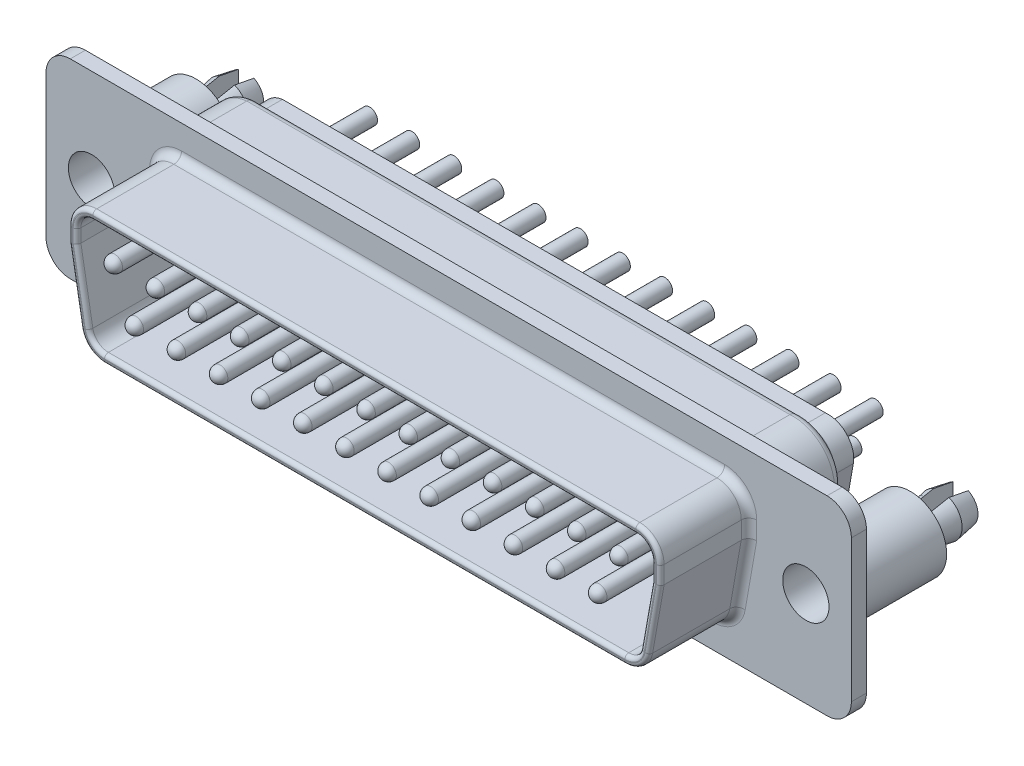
SolidWorks part; units mm, degrees
ref_plane "Plane1" through (0, 0, 0) normal (0, 0, 1) x (1, 0, 0)
ref_plane "Plane2" through (0, 0, 0) normal (0, 1, 0) x (1, 0, 0)
ref_plane "Plane3" through (0, 0, 0) normal (1, 0, 0) x (0, 0, -1)
sketch "Sketch1" plane through (0, 0, 0) normal (0, 0, 1) x (1, 0, 0)
  line L0 (0, 19.6596) -> (0, -19.1008) construction
  line L1 (-24.9174, 6.2738) -> (24.9174, 6.2738)
  line L2 (24.9174, -6.2738) -> (-24.9174, -6.2738)
  line L3 (26.5176, 4.6736) -> (26.5176, -4.6736)
  line L4 (-26.5176, 4.6736) -> (-26.5176, -4.6736)
  arc A0 (26.5176, 4.6736) -> (24.9174, 6.2738) centre (24.9174, 4.6736) ccw
  arc A1 (24.9174, -6.2738) -> (26.5176, -4.6736) centre (24.9174, -4.6736) ccw
  arc A2 (-26.5176, -4.6736) -> (-24.9174, -6.2738) centre (-24.9174, -4.6736) ccw
  arc A3 (-24.9174, 6.2738) -> (-26.5176, 4.6736) centre (-24.9174, 4.6736) ccw
  point P9 (26.5176, 6.2738)
  point P12 (26.5176, -6.2738)
  point P15 (-26.5176, -6.2738)
  point P18 (-26.5176, 6.2738)
  dimension "D1" = 1.6002
extrude "Base-Extrude" add sketch "Sketch1" against normal blind 0.9906
sketch "Sketch3" plane through (0, 0, 0) normal (0, 0, 1) x (1, 0, 0)
  line L0 (0, 9.4234) -> (0, -12.192) construction
  line L1 (-17.5895, 4.1783) -> (18.1737, 4.1783)
  line L2 (17.4436, -4.1783) -> (-16.8191, -4.1783)
  line L4 (19.7739, 1.4224) -> (19.0195, -2.856)
  line L5 (19.7739, 2.5781) -> (19.7739, 1.4224)
  line L6 (-19.1897, 1.651) -> (-18.395, -2.856)
  line L7 (-19.1897, 2.5781) -> (-19.1897, 1.651)
  arc A0 (18.1737, 4.1783) -> (19.7739, 2.5781) centre (18.1737, 2.5781) cw
  arc A1 (17.4436, -4.1783) -> (19.0195, -2.856) centre (17.4436, -2.5781) ccw
  arc A2 (-18.395, -2.856) -> (-16.8191, -4.1783) centre (-16.8191, -2.5781) ccw
  arc A3 (-17.5895, 4.1783) -> (-19.1897, 2.5781) centre (-17.5895, 2.5781) ccw
  point P19 (19.7739, 4.1783)
  point P26 (-19.1897, 4.1783)
  dimension "D7" = 1.6002
  dimension "D1" = 38.9636
  dimension "D3" = 4.1783
  dimension "D4" = 4.1783
  dimension "D5" = 10
  dimension "D6" = 10
extrude "Boss-Extrude2" add sketch "Sketch3" along normal blind 5.842
sketch "Sketch10" plane through (0, 0, 0) normal (0, 0, 1) x (1, 0, 0)
  line L0 (0, 10.3378) -> (0, -10.8966) construction
  line L1 (-24.9174, 6.2738) -> (24.9174, 6.2738) construction
  circle A0 centre (23.5204, 0) radius 1.524
  circle A1 centre (-23.5204, 0) radius 1.524
  dimension "D1" = 3.048
  dimension "D2" = 6.2738
  dimension "D3" = 47.0408
extrude "Cut-Extrude5" cut sketch "Sketch10" against normal through all
sketch "Sketch11" plane through (0, 0, 5.842) normal (0, 0, 1) x (1, 0, 0)
  circle A0 centre (0, 1.4224) radius 0.508
  circle A2 centre (16.6497, 1.4224) radius 0.508
  circle A3 centre (11.1023, 1.4224) radius 0.508
  circle A4 centre (-2.7813, 1.4224) radius 0.508
  circle A5 centre (8.3287, 1.4224) radius 0.508
  circle A6 centre (-8.3287, 1.4224) radius 0.508
  circle A7 centre (5.555, 1.4224) radius 0.508
  circle A8 centre (-11.1023, 1.4224) radius 0.508
  circle A9 centre (2.7813, 1.4224) radius 0.508
  circle A10 centre (-13.876, 1.4224) radius 0.508
  circle A11 centre (13.876, 1.4224) radius 0.508
  circle A12 centre (-16.6497, 1.4224) radius 0.508
  circle A13 centre (15.2476, -1.4224) radius 0.508
  circle A25 centre (-5.555, 1.4224) radius 0.508
  circle A26 centre (-15.2629, -1.4224) radius 0.508
  circle A27 centre (12.4739, -1.4224) radius 0.508
  circle A28 centre (-12.4892, -1.4224) radius 0.508
  circle A29 centre (9.7003, -1.4224) radius 0.508
  circle A30 centre (-9.7155, -1.4224) radius 0.508
  circle A31 centre (6.9266, -1.4224) radius 0.508
  circle A32 centre (-6.9418, -1.4224) radius 0.508
  circle A33 centre (4.1529, -1.4224) radius 0.508
  circle A34 centre (-4.1681, -1.4224) radius 0.508
  circle A35 centre (1.3792, -1.4224) radius 0.508
  circle A36 centre (-1.3945, -1.4224) radius 0.508
  dimension "D2" = 1.016
  dimension "D5" = 2.7737
  dimension "D6" = 2.7737
  dimension "D7" = 2.7737
  dimension "D8" = 2.7737
  dimension "D9" = 2.7737
  dimension "D10" = 2.7737
  dimension "D11" = 2.7737
  dimension "D12" = 2.7737
  dimension "D13" = 2.7737
  dimension "D14" = 2.7737
  dimension "D15" = 1.3868
  dimension "D16" = 2.7737
  dimension "D17" = 2.7737
  dimension "D18" = 2.7737
  dimension "D19" = 2.7737
  dimension "D20" = 2.7737
  dimension "D21" = 2.7737
  dimension "D22" = 2.7737
  dimension "D23" = 2.7737
  dimension "D24" = 2.7737
  dimension "D25" = 2.7737
  dimension "D26" = 2.7737
ref_plane "Plane5" through (5.715, 0, 0) normal (1, 0, 0) x (0, 0, -1)
sketch "Sketch16" plane through (0, 0, 5.842) normal (0, 0, 1) x (1, 0, 0)
  line L6 (19.2151, 1.4713) -> (19.2151, 2.5781)
  line L7 (18.1737, 3.6195) -> (-17.5895, 3.6195)
  line L8 (-18.6309, 2.5781) -> (-18.6309, 1.6999)
  line L9 (-18.6309, 1.6999) -> (-17.8447, -2.7589)
  line L10 (-16.8191, -3.6195) -> (17.4436, -3.6195)
  line L11 (18.4692, -2.7589) -> (19.2151, 1.4713)
  line L12 (19.2151, 1.4713) -> (19.2151, 2.5781)
  line L13 (18.1737, 3.6195) -> (-17.5895, 3.6195)
  line L14 (-18.6309, 2.5781) -> (-18.6309, 1.6999)
  line L15 (-18.6309, 1.6999) -> (-17.8447, -2.7589)
  line L16 (-16.8191, -3.6195) -> (17.4436, -3.6195)
  line L17 (18.4692, -2.7589) -> (19.2151, 1.4713)
  arc A4 (19.2151, 2.5781) -> (18.1737, 3.6195) centre (18.1737, 2.5781) ccw
  arc A5 (-17.5895, 3.6195) -> (-18.6309, 2.5781) centre (-17.5895, 2.5781) ccw
  arc A6 (-17.8447, -2.7589) -> (-16.8191, -3.6195) centre (-16.8191, -2.5781) ccw
  arc A7 (17.4436, -3.6195) -> (18.4692, -2.7589) centre (17.4436, -2.5781) ccw
  arc A8 (19.2151, 2.5781) -> (18.1737, 3.6195) centre (18.1737, 2.5781) ccw
  arc A9 (-17.5895, 3.6195) -> (-18.6309, 2.5781) centre (-17.5895, 2.5781) ccw
  arc A10 (-17.8447, -2.7589) -> (-16.8191, -3.6195) centre (-16.8191, -2.5781) ccw
  arc A11 (17.4436, -3.6195) -> (18.4692, -2.7589) centre (17.4436, -2.5781) ccw
  dimension "D1" = 0.5588
extrude "Cut-Extrude6" cut sketch "Sketch16" against normal blind 5.842
extrude "Boss-Extrude7" add sketch "Sketch11" against normal blind 5.842
fillet "Fillet1" radius 0.508 25 edges at (0.508, 1.4224, 5.842) (-17.1577, 1.4224, 5.842) (-14.384, 1.4224, 5.842) (-11.6103, 1.4224, 5.842) (-8.8367, 1.4224, 5.842) (-6.063, 1.4224, 5.842) (-3.2893, 1.4224, 5.842) (2.2733, 1.4224, 5.842) (5.047, 1.4224, 5.842) (7.8207, 1.4224, 5.842) (10.5943, 1.4224, 5.842) (13.368, 1.4224, 5.842) (16.1417, 1.4224, 5.842) (15.7556, -1.4224, 5.842) (12.9819, -1.4224, 5.842) (10.2083, -1.4224, 5.842) (7.4346, -1.4224, 5.842) (4.6609, -1.4224, 5.842) (1.8872, -1.4224, 5.842) (-1.9025, -1.4224, 5.842) (-4.6761, -1.4224, 5.842) (-7.4498, -1.4224, 5.842) (-10.2235, -1.4224, 5.842) (-12.9972, -1.4224, 5.842) (-15.7709, -1.4224, 5.842)
fillet "Fillet3" radius 0.254 20 edges at (19.7739, 2.0003, 5.842) (19.3052, 3.7096, 5.842) (0.2921, 4.1783, 5.842) (0.3123, -4.1783, 5.842) (19.3967, -0.7168, 5.842) (-18.721, 3.7096, 5.842) (-19.1897, 2.1146, 5.842) (-18.7923, -0.6025, 5.842) (-17.8477, -3.8039, 5.842) (18.4722, -3.8039, 5.842) (18.8421, -0.6438, 5.842) (19.2151, 2.0247, 5.842) (18.9101, 3.3145, 5.842) (0.2921, 3.6195, 5.842) (-18.3259, 3.3145, 5.842) (-18.6309, 2.139, 5.842) (-18.2378, -0.5295, 5.842) (-17.4885, -3.3759, 5.842) (0.3123, -3.6195, 5.842) (18.113, -3.3759, 5.842)
fillet "Fillet4" radius 0.508 10 edges at (-18.721, 3.7096, 0) (-19.1897, 2.1146, 0) (-18.7923, -0.6025, 0) (-17.8477, -3.8039, 0) (18.4722, -3.8039, 0) (19.7739, 2.0003, 0) (19.3967, -0.7168, 0) (0.3123, -4.1783, 0) (0.2921, 4.1783, 0) (19.3052, 3.7096, 0)
sketch "Sketch17" plane through (0, 0, -0.9906) normal (0, 0, -1) x (-1, 0, 0)
  line L12 (17.891, 5.0831) -> (-17.8722, 5.0831)
  line L13 (-20.7641, 1.9186) -> (-19.8811, -3.089)
  line L14 (-17.3638, -5.0673) -> (16.7763, -5.0673)
  line L15 (19.2779, -2.9682) -> (20.0803, 1.5826)
  arc A0 (20.0803, 1.5826) -> (17.891, 5.0831) centre (17.6129, 2.4742) ccw
  arc A9 (16.7763, -5.0673) -> (19.2779, -2.9682) centre (16.8191, -2.5781) ccw
  arc A10 (-17.3638, -5.0673) -> (-19.8811, -3.089) centre (-17.4436, -2.5781) cw
  arc A11 (-20.7641, 1.9186) -> (-17.8722, 5.0831) centre (-18.1007, 2.3882) cw
extrude "Boss-Extrude8" add sketch "Sketch17" along normal blind 4.1148
sketch "Sketch18" plane through (0, 0, -5.1054) normal (0, 0, -1) x (-1, 0, 0)
  line L12 (17.8304, 4.0671) -> (-17.9202, 4.0671)
  line L13 (-19.7635, 2.095) -> (-18.8838, -2.8944)
  line L14 (-17.3822, -4.0513) -> (16.7862, -4.0513)
  line L15 (18.2756, -2.8015) -> (19.0969, 1.856)
  line L16 (17.8304, 4.0671) -> (-17.9202, 4.0671)
  line L17 (-19.7635, 2.095) -> (-18.8838, -2.8944)
  line L18 (-17.3822, -4.0513) -> (16.7862, -4.0513)
  line L19 (18.2756, -2.8015) -> (19.0969, 1.856)
  arc A12 (19.0969, 1.856) -> (17.8304, 4.0671) centre (17.6129, 2.4742) ccw
  arc A13 (-17.9202, 4.0671) -> (-19.7635, 2.095) centre (-18.1007, 2.3882) ccw
  arc A14 (-18.8838, -2.8944) -> (-17.3822, -4.0513) centre (-17.4436, -2.5781) ccw
  arc A15 (16.7862, -4.0513) -> (18.2756, -2.8015) centre (16.8191, -2.5781) ccw
  arc A16 (19.0969, 1.856) -> (17.8304, 4.0671) centre (17.6129, 2.4742) ccw
  arc A17 (-17.9202, 4.0671) -> (-19.7635, 2.095) centre (-18.1007, 2.3882) ccw
  arc A18 (-18.8838, -2.8944) -> (-17.3822, -4.0513) centre (-17.4436, -2.5781) ccw
  arc A19 (16.7862, -4.0513) -> (18.2756, -2.8015) centre (16.8191, -2.5781) ccw
  dimension "D2" = 1.016
extrude "Boss-Extrude9" add sketch "Sketch18" along normal blind 1.778
fillet "Fillet8" radius 0.508 16 edges at (20.0971, 4.2127, -5.1054) (18.9825, -4.5363, -5.1054) (-19.8373, 3.8655, -5.1054) (-0.0094, 5.0831, -5.1054) (20.3226, -0.5852, -5.1054) (0.2937, -5.0673, -5.1054) (-18.4194, -4.4852, -5.1054) (-19.6791, -0.6928, -5.1054) (-19.0079, 3.2733, -5.1054) (0.0449, 4.0671, -5.1054) (19.3342, 3.5413, -5.1054) (19.3237, -0.3997, -5.1054) (18.3435, -3.7461, -5.1054) (0.298, -4.0513, -5.1054) (-17.7663, -3.7069, -5.1054) (-18.6863, -0.4727, -5.1054)
sketch "Sketch19" plane through (0, 0, -6.8834) normal (0, 0, -1) x (-1, 0, 0)
  circle A0 centre (-16.6497, 1.4224) radius 0.508 construction
  circle A1 centre (-16.6497, 1.4224) radius 0.508
  circle A2 centre (-13.876, 1.4224) radius 0.508 construction
  circle A3 centre (-13.876, 1.4224) radius 0.508
  circle A4 centre (5.555, 1.4224) radius 0.508 construction
  circle A5 centre (5.555, 1.4224) radius 0.508
  circle A6 centre (16.6497, 1.4224) radius 0.508 construction
  circle A7 centre (16.6497, 1.4224) radius 0.508
  circle A8 centre (15.2629, -1.4224) radius 0.508 construction
  circle A9 centre (15.2629, -1.4224) radius 0.508
  circle A10 centre (12.4892, -1.4224) radius 0.508 construction
  circle A11 centre (12.4892, -1.4224) radius 0.508
  circle A12 centre (13.876, 1.4224) radius 0.508 construction
  circle A13 centre (13.876, 1.4224) radius 0.508
  circle A14 centre (11.1023, 1.4224) radius 0.508 construction
  circle A15 centre (11.1023, 1.4224) radius 0.508
  circle A16 centre (9.7155, -1.4224) radius 0.508 construction
  circle A17 centre (9.7155, -1.4224) radius 0.508
  circle A18 centre (6.9418, -1.4224) radius 0.508 construction
  circle A19 centre (6.9418, -1.4224) radius 0.508
  circle A20 centre (8.3287, 1.4224) radius 0.508 construction
  circle A21 centre (8.3287, 1.4224) radius 0.508
  circle A22 centre (4.1681, -1.4224) radius 0.508 construction
  circle A23 centre (4.1681, -1.4224) radius 0.508
  circle A24 centre (1.3945, -1.4224) radius 0.508 construction
  circle A25 centre (1.3945, -1.4224) radius 0.508
  circle A26 centre (2.7813, 1.4224) radius 0.508 construction
  circle A27 centre (2.7813, 1.4224) radius 0.508
  circle A28 centre (0, 1.4224) radius 0.508 construction
  circle A29 centre (0, 1.4224) radius 0.508
  circle A30 centre (-1.3792, -1.4224) radius 0.508 construction
  circle A31 centre (-1.3792, -1.4224) radius 0.508
  circle A32 centre (-4.1529, -1.4224) radius 0.508 construction
  circle A33 centre (-4.1529, -1.4224) radius 0.508
  circle A34 centre (-2.7813, 1.4224) radius 0.508 construction
  circle A35 centre (-2.7813, 1.4224) radius 0.508
  circle A36 centre (-5.555, 1.4224) radius 0.508 construction
  circle A37 centre (-5.555, 1.4224) radius 0.508
  circle A38 centre (-6.9266, -1.4224) radius 0.508 construction
  circle A39 centre (-6.9266, -1.4224) radius 0.508
  circle A40 centre (-9.7003, -1.4224) radius 0.508 construction
  circle A41 centre (-9.7003, -1.4224) radius 0.508
  circle A42 centre (-8.3287, 1.4224) radius 0.508 construction
  circle A43 centre (-8.3287, 1.4224) radius 0.508
  circle A44 centre (-12.4739, -1.4224) radius 0.508 construction
  circle A45 centre (-12.4739, -1.4224) radius 0.508
  circle A46 centre (-11.1023, 1.4224) radius 0.508 construction
  circle A47 centre (-11.1023, 1.4224) radius 0.508
  circle A48 centre (-15.2476, -1.4224) radius 0.508 construction
  circle A49 centre (-15.2476, -1.4224) radius 0.508
extrude "Boss-Extrude10" add sketch "Sketch19" along normal blind 4.572
sketch "Sketch20" plane through (0, 0, -0.9906) normal (0, 0, -1) x (-1, 0, 0)
  circle A0 centre (23.5204, 0) radius 2.3876
  circle A1 centre (-23.5204, 0) radius 2.3876
  dimension "D1" = 4.7752
extrude "Boss-Extrude11" add sketch "Sketch20" along normal blind 5.8928
sketch "Sketch21" plane through (0, 0, -0.9906) normal (0, 0, 1) x (1, 0, 0)
  circle A1 centre (23.5204, 0) radius 1.524
  circle A2 centre (23.5204, 0) radius 1.524
  circle A3 centre (-23.5204, 0) radius 1.524
  circle A4 centre (-23.5204, 0) radius 1.524
  dimension "D1" = 0
  dimension "D2" = 0
extrude "Cut-Extrude7" cut sketch "Sketch21" against normal blind 3.175
sketch "Sketch22" plane through (0, 0, -6.8834) normal (0, 0, -1) x (-1, 0, 0)
  circle A0 centre (23.5204, 0) radius 1.016
  circle A1 centre (-23.5204, 0) radius 1.016
  dimension "D1" = 2.032
extrude "Boss-Extrude12" add sketch "Sketch22" along normal blind 2.032 draft 10
sketch "Sketch23" plane through (0, 0, -8.9154) normal (0, 0, -1) x (-1, 0, 0)
  circle A1 centre (-23.5204, 0) radius 1.3743
  circle A2 centre (-23.5204, 0) radius 1.3743
  circle A3 centre (23.5204, 0) radius 1.3743
  circle A4 centre (23.5204, 0) radius 1.3743
  dimension "D1" = 0
  dimension "D2" = 0
extrude "Boss-Extrude13" add sketch "Sketch23" along normal blind 1.27 draft 10
sketch "Sketch24" plane through (0, 0, -10.1854) normal (0, 0, -1) x (-1, 0, 0)
  line L1 (-24.0284, 1.277) -> (-24.0284, -1.277)
  line L3 (-23.0124, -1.277) -> (-23.0124, 1.277)
  line L5 (23.0124, 1.277) -> (23.0124, -1.277)
  line L7 (24.0284, -1.277) -> (24.0284, 1.277)
  circle A0 centre (-23.5204, 0) radius 1.3743 construction
  arc A1 (-24.0284, -1.277) -> (-23.0124, -1.277) centre (-23.5204, 0) ccw
  circle A2 centre (23.5204, 0) radius 1.3743 construction
  arc A3 (24.0284, 1.277) -> (23.0124, 1.277) centre (23.5204, 0) ccw
  arc A4 (23.0124, -1.277) -> (24.0284, -1.277) centre (23.5204, 0) ccw
  arc A5 (-23.0124, 1.277) -> (-24.0284, 1.277) centre (-23.5204, 0) ccw
  dimension "D1" = 0.508
  dimension "D2" = 0.508
  dimension "D3" = 0.508
  dimension "D4" = 0.508
extrude "Cut-Extrude8" cut sketch "Sketch24" against normal up to surface (3.302 mm away)
